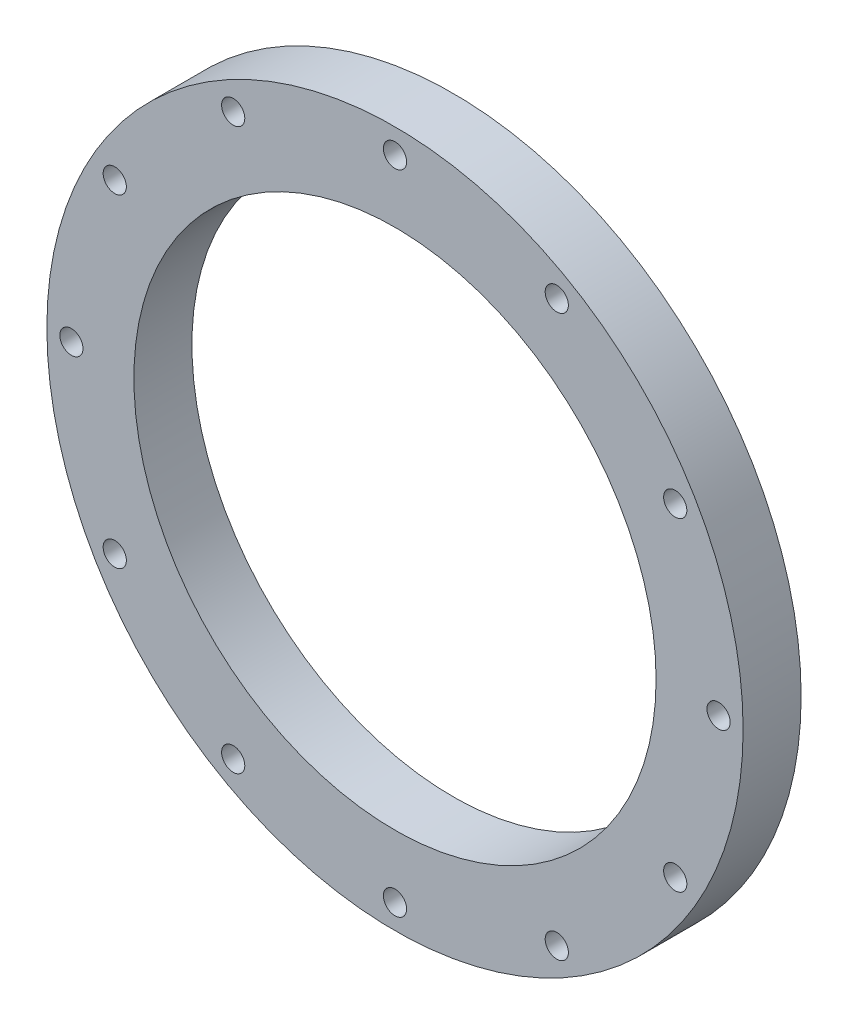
SolidWorks part; units mm, degrees
ref_plane "Front Plane" through (0, 0, 0) normal (0, 0, 1) x (1, 0, 0)
ref_plane "Top Plane" through (0, 0, 0) normal (0, 1, 0) x (1, 0, 0)
ref_plane "Right Plane" through (0, 0, 0) normal (1, 0, 0) x (0, 0, -1)
sketch "Sketch1" plane through (0, 0, 0) normal (0, 0, 1) x (1, 0, 0)
  circle A0 centre (0, 0) radius 300
  circle A1 centre (0, 0) radius 225
  circle A2 centre (0, 278.8475) radius 9.9952
  circle A3 centre (139.4237, 241.489) radius 9.9952
  circle A4 centre (241.489, 139.4237) radius 9.9952
  circle A5 centre (278.8475, 0) radius 9.9952
  circle A6 centre (241.489, -139.4237) radius 9.9952
  circle A7 centre (139.4237, -241.489) radius 9.9952
  circle A8 centre (0, -278.8475) radius 9.9952
  circle A9 centre (-139.4237, -241.489) radius 9.9952
  circle A10 centre (-241.489, -139.4237) radius 9.9952
  circle A11 centre (-278.8475, 0) radius 9.9952
  circle A12 centre (-241.489, 139.4237) radius 9.9952
  circle A13 centre (-139.4237, 241.489) radius 9.9952
  point P31 (0, 0)
  dimension "D1" = 600
  dimension "D2" = 450
  dimension "D3" = 12
extrude "Boss-Extrude1" add sketch "Sketch1" along normal blind 50
